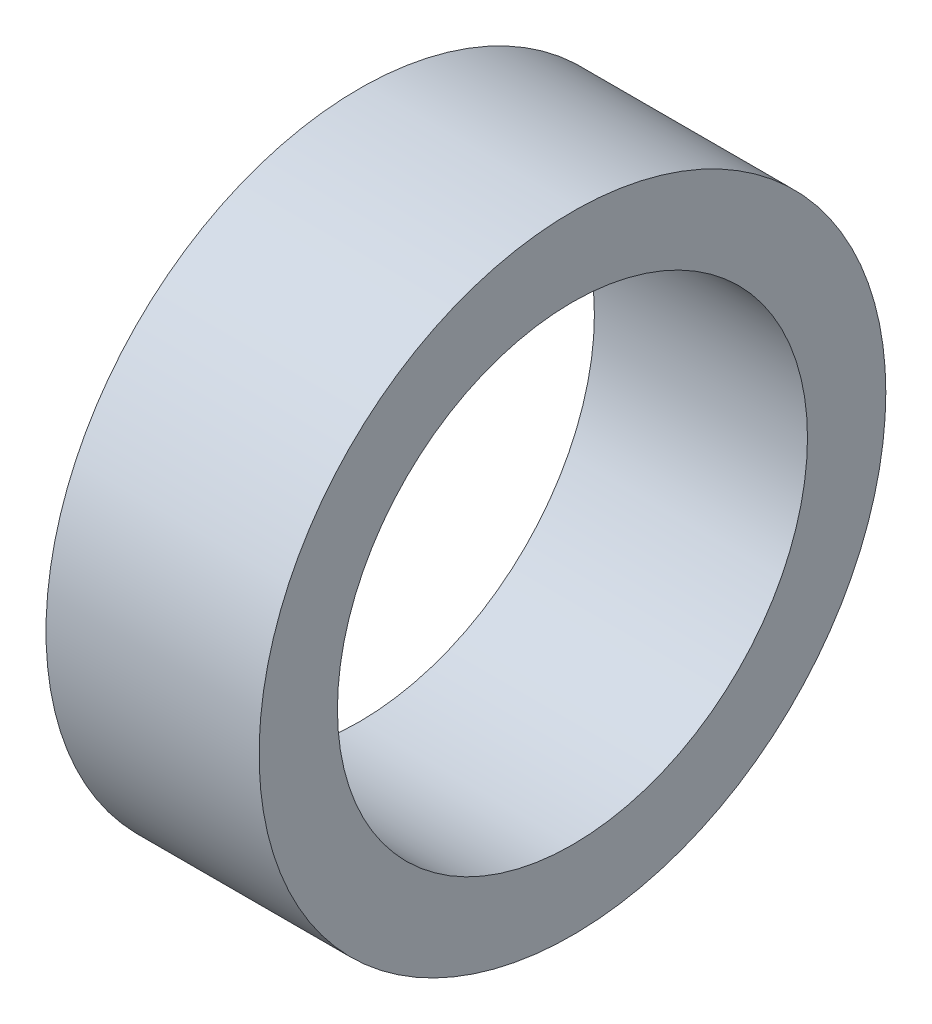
SolidWorks part; units mm, degrees
ref_plane "Front Plane" through (0, 0, 0) normal (0, 0, 1) x (1, 0, 0)
ref_plane "Top Plane" through (0, 0, 0) normal (0, 1, 0) x (1, 0, 0)
ref_plane "Right Plane" through (0, 0, 0) normal (1, 0, 0) x (0, 0, -1)
sketch "Sketch1" plane through (0, 0, 0) normal (1, 0, 0) x (0, 0, -1)
  circle A0 centre (0, 0) radius 7.5
  circle A1 centre (0, 0) radius 10
  dimension "D1" = 20
  dimension "D2" = 15
extrude "Boss-Extrude1" add sketch "Sketch1" along normal blind 6.8
